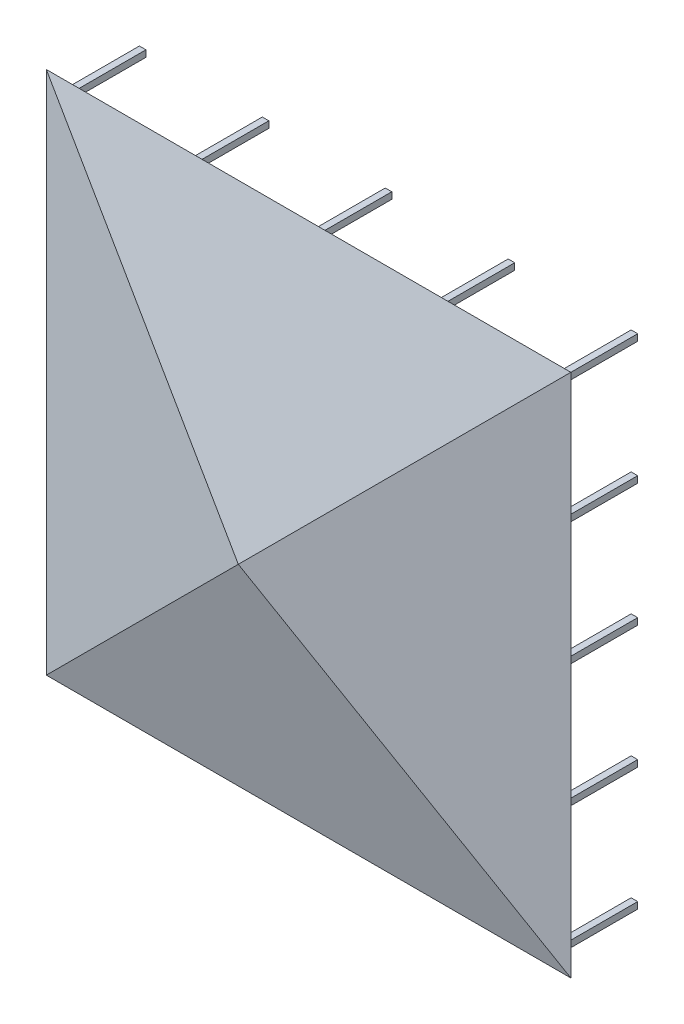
SolidWorks part; units mm, degrees
ref_plane "Front Plane" through (0, 0, 0) normal (1, 0, 0) x (0, 1, 0)
ref_plane "Top Plane" through (0, 0, 0) normal (0, 0, 1) x (0, 1, 0)
ref_plane "Right Plane" through (0, 0, 0) normal (0, 1, 0) x (-1, 0, 0)
sketch "Sketch1" plane through (0, 0, 0) normal (0, 0, 1) x (0, 1, 0)
  line L1 (-7500, 7500) -> (7500, 7500)
  line L2 (-7500, 7500) -> (-7500, -7500)
  line L3 (-7500, -7500) -> (7500, -7500)
  line L4 (7500, 7500) -> (7500, -7500)
  line L5 (-7500, 7500) -> (7500, -7500) construction
  line L6 (-7500, -7500) -> (7500, 7500) construction
  point P0 (0, 0)
  dimension "D1" = 15000
  dimension "D2" = 15000
sketch "Sketch2" plane through (0, 0, 0) normal (0, 0, 1) x (0, 1, 0)
  line L0 (-3850, -7600) -> (-3650, -7600)
  line L5 (-3850, -7600) -> (-3850, -7400)
  line L6 (-3850, -7400) -> (-3650, -7400)
  line L7 (-7500, -7500) -> (7500, 7500) construction
  line L12 (-3650, -7600) -> (-3650, -7400)
  line L13 (-3850, -7600) -> (-3650, -7400) construction
  line L14 (-3850, -7400) -> (-3650, -7600) construction
  line L19 (-100, -7600) -> (100, -7600)
  line L20 (-100, -7600) -> (-100, -7400)
  line L21 (-7600, -7600) -> (-7400, -7600)
  line L22 (-7600, -7600) -> (-7600, -7400)
  line L23 (-7600, -7400) -> (-7400, -7400)
  line L24 (-7400, -7600) -> (-7400, -7400)
  line L25 (-7600, -7600) -> (-7400, -7400) construction
  line L26 (-7600, -7400) -> (-7400, -7600) construction
  line L27 (-100, -7400) -> (100, -7400)
  line L28 (100, -7600) -> (100, -7400)
  line L29 (-100, -7600) -> (100, -7400) construction
  line L30 (-100, -7400) -> (100, -7600) construction
  line L31 (3650, -7600) -> (3850, -7600)
  line L32 (3650, -7600) -> (3650, -7400)
  line L33 (3650, -7400) -> (3850, -7400)
  line L34 (3850, -7600) -> (3850, -7400)
  line L35 (3650, -7600) -> (3850, -7400) construction
  line L36 (3650, -7400) -> (3850, -7600) construction
  line L37 (7400, -7600) -> (7600, -7600)
  line L38 (7400, -7600) -> (7400, -7400)
  line L39 (7400, -7400) -> (7600, -7400)
  line L40 (7600, -7600) -> (7600, -7400)
  line L41 (7400, -7600) -> (7600, -7400) construction
  line L42 (7400, -7400) -> (7600, -7600) construction
  line L61 (7400, -3850) -> (7600, -3850)
  line L62 (7400, -3850) -> (7400, -3650)
  line L63 (7400, -3650) -> (7600, -3650)
  line L64 (7600, -3850) -> (7600, -3650)
  line L65 (7400, -3850) -> (7600, -3650) construction
  line L66 (7400, -3650) -> (7600, -3850) construction
  line L85 (7400, -100) -> (7600, -100)
  line L86 (7400, -100) -> (7400, 100)
  line L87 (7400, 100) -> (7600, 100)
  line L88 (7600, -100) -> (7600, 100)
  line L89 (7400, -100) -> (7600, 100) construction
  line L90 (7400, 100) -> (7600, -100) construction
  line L109 (7400, 3650) -> (7600, 3650)
  line L110 (7400, 3650) -> (7400, 3850)
  line L111 (7400, 3850) -> (7600, 3850)
  line L112 (7600, 3650) -> (7600, 3850)
  line L113 (7400, 3650) -> (7600, 3850) construction
  line L114 (7400, 3850) -> (7600, 3650) construction
  line L115 (-3850, 7400) -> (-3650, 7400)
  line L116 (-3850, 7400) -> (-3850, 7600)
  line L117 (-3850, 7600) -> (-3650, 7600)
  line L118 (-3650, 7400) -> (-3650, 7600)
  line L119 (-3850, 7400) -> (-3650, 7600) construction
  line L120 (-3850, 7600) -> (-3650, 7400) construction
  line L121 (-100, 7400) -> (100, 7400)
  line L122 (-100, 7400) -> (-100, 7600)
  line L123 (-100, 7600) -> (100, 7600)
  line L124 (100, 7400) -> (100, 7600)
  line L125 (-100, 7400) -> (100, 7600) construction
  line L126 (-100, 7600) -> (100, 7400) construction
  line L127 (3650, 7400) -> (3850, 7400)
  line L128 (3650, 7400) -> (3650, 7600)
  line L129 (3650, 7600) -> (3850, 7600)
  line L130 (3850, 7400) -> (3850, 7600)
  line L131 (3650, 7400) -> (3850, 7600) construction
  line L132 (3650, 7600) -> (3850, 7400) construction
  line L133 (7400, 7400) -> (7600, 7400)
  line L134 (7400, 7400) -> (7400, 7600)
  line L135 (7400, 7600) -> (7600, 7600)
  line L136 (7600, 7400) -> (7600, 7600)
  line L137 (7400, 7400) -> (7600, 7600) construction
  line L138 (7400, 7600) -> (7600, 7400) construction
  line L139 (-7600, -3850) -> (-7400, -3850)
  line L140 (-7600, -3850) -> (-7600, -3650)
  line L141 (-7600, -3650) -> (-7400, -3650)
  line L142 (-7400, -3850) -> (-7400, -3650)
  line L143 (-7600, -3850) -> (-7400, -3650) construction
  line L144 (-7600, -3650) -> (-7400, -3850) construction
  line L145 (-7600, -100) -> (-7400, -100)
  line L146 (-7600, -100) -> (-7600, 100)
  line L147 (-7600, 100) -> (-7400, 100)
  line L148 (-7400, -100) -> (-7400, 100)
  line L149 (-7600, -100) -> (-7400, 100) construction
  line L150 (-7600, 100) -> (-7400, -100) construction
  line L151 (-7600, 3650) -> (-7400, 3650)
  line L152 (-7600, 3650) -> (-7600, 3850)
  line L153 (-7600, 3850) -> (-7400, 3850)
  line L154 (-7400, 3650) -> (-7400, 3850)
  line L155 (-7600, 3650) -> (-7400, 3850) construction
  line L156 (-7600, 3850) -> (-7400, 3650) construction
  line L157 (-7600, 7400) -> (-7400, 7400)
  line L158 (-7600, 7400) -> (-7600, 7600)
  line L159 (-7600, 7600) -> (-7400, 7600)
  line L160 (-7400, 7400) -> (-7400, 7600)
  line L161 (-7600, 7400) -> (-7400, 7600) construction
  line L162 (-7600, 7600) -> (-7400, 7400) construction
  line L163 (-3850, -3850) -> (-3650, -3850)
  line L164 (-3850, -3850) -> (-3850, -3650)
  line L165 (-3850, -3650) -> (-3650, -3650)
  line L166 (-3650, -3850) -> (-3650, -3650)
  line L167 (-100, -3850) -> (100, -3850)
  line L168 (-100, -3850) -> (-100, -3650)
  line L169 (-100, -3650) -> (100, -3650)
  line L170 (100, -3850) -> (100, -3650)
  line L171 (3650, -3850) -> (3850, -3850)
  line L172 (3650, -3850) -> (3650, -3650)
  line L173 (3650, -3650) -> (3850, -3650)
  line L174 (3850, -3850) -> (3850, -3650)
  line L175 (-3850, -100) -> (-3650, -100)
  line L176 (-3850, -100) -> (-3850, 100)
  line L177 (-3850, 100) -> (-3650, 100)
  line L178 (-3650, -100) -> (-3650, 100)
  line L179 (-100, -100) -> (100, -100)
  line L180 (-100, -100) -> (-100, 100)
  line L181 (-100, 100) -> (100, 100)
  line L182 (100, -100) -> (100, 100)
  line L183 (3650, -100) -> (3850, -100)
  line L184 (3650, -100) -> (3650, 100)
  line L185 (3650, 100) -> (3850, 100)
  line L186 (3850, -100) -> (3850, 100)
  line L187 (-3850, 3650) -> (-3650, 3650)
  line L188 (-3850, 3650) -> (-3850, 3850)
  line L189 (-3850, 3850) -> (-3650, 3850)
  line L190 (-3650, 3650) -> (-3650, 3850)
  line L191 (-100, 3650) -> (100, 3650)
  line L192 (-100, 3650) -> (-100, 3850)
  line L193 (-100, 3850) -> (100, 3850)
  line L194 (100, 3650) -> (100, 3850)
  line L195 (3650, 3650) -> (3850, 3650)
  line L196 (3650, 3650) -> (3650, 3850)
  line L197 (3650, 3850) -> (3850, 3850)
  line L198 (3850, 3650) -> (3850, 3850)
  line L199 (-3850, -3850) -> (-3650, -3650) construction
  line L200 (-3850, -3650) -> (-3650, -3850) construction
  line L201 (-100, -3850) -> (100, -3650) construction
  line L202 (-100, -3650) -> (100, -3850) construction
  line L203 (3650, -3850) -> (3850, -3650) construction
  line L204 (3650, -3650) -> (3850, -3850) construction
  line L205 (-3850, -100) -> (-3650, 100) construction
  line L206 (-3850, 100) -> (-3650, -100) construction
  line L207 (-100, -100) -> (100, 100) construction
  line L208 (-100, 100) -> (100, -100) construction
  line L209 (3650, -100) -> (3850, 100) construction
  line L210 (3650, 100) -> (3850, -100) construction
  line L211 (-3850, 3650) -> (-3650, 3850) construction
  line L212 (-3850, 3850) -> (-3650, 3650) construction
  line L213 (-100, 3650) -> (100, 3850) construction
  line L214 (-100, 3850) -> (100, 3650) construction
  line L215 (3650, 3650) -> (3850, 3850) construction
  line L216 (3650, 3850) -> (3850, 3650) construction
  point P0 (3750, 3750)
  point P1 (0, 3750)
  point P2 (-3750, 3750)
  point P3 (-3750, -7500)
  point P8 (0, -7500)
  point P13 (3750, -7500)
  point P20 (7500, -7500)
  point P22 (-7500, -7500)
  point P32 (3750, 0)
  point P33 (0, 0)
  point P34 (-3750, 0)
  point P35 (3750, -3750)
  point P36 (-3750, -3750)
  point P37 (0, -3750)
  point P46 (7500, -3750)
  point P66 (7500, 0)
  point P86 (7500, 3750)
  point P91 (-3750, 7500)
  point P96 (0, 7500)
  point P101 (3750, 7500)
  point P106 (7500, 7500)
  point P111 (-7500, -3750)
  point P116 (-7500, 0)
  point P121 (-7500, 3750)
  point P126 (-7500, 7500)
  dimension "D1" = 5
  dimension "D2" = 5
  dimension "D3" = 200
extrude "Boss-Extrude1" add sketch "Sketch2" along normal blind 2438.4
sketch "Sketch3" plane through (0, 0, 2438.4) normal (0, 0, 1) x (1, 0, 0)
  line L8 (-8000, -8000) -> (8000, -8000)
  line L9 (-8000, 8000) -> (-8000, -8000)
  line L10 (8000, 8000) -> (-8000, 8000)
  line L11 (8000, -8000) -> (8000, 8000)
  line L12 (-8000, -8000) -> (8000, -8000)
  line L13 (-8000, 8000) -> (-8000, -8000)
  line L14 (8000, 8000) -> (-8000, 8000)
  line L15 (8000, -8000) -> (8000, 8000)
  dimension "D1" = 500
extrude "Boss-Extrude2" add sketch "Sketch3" along normal blind 2500 draft 75
